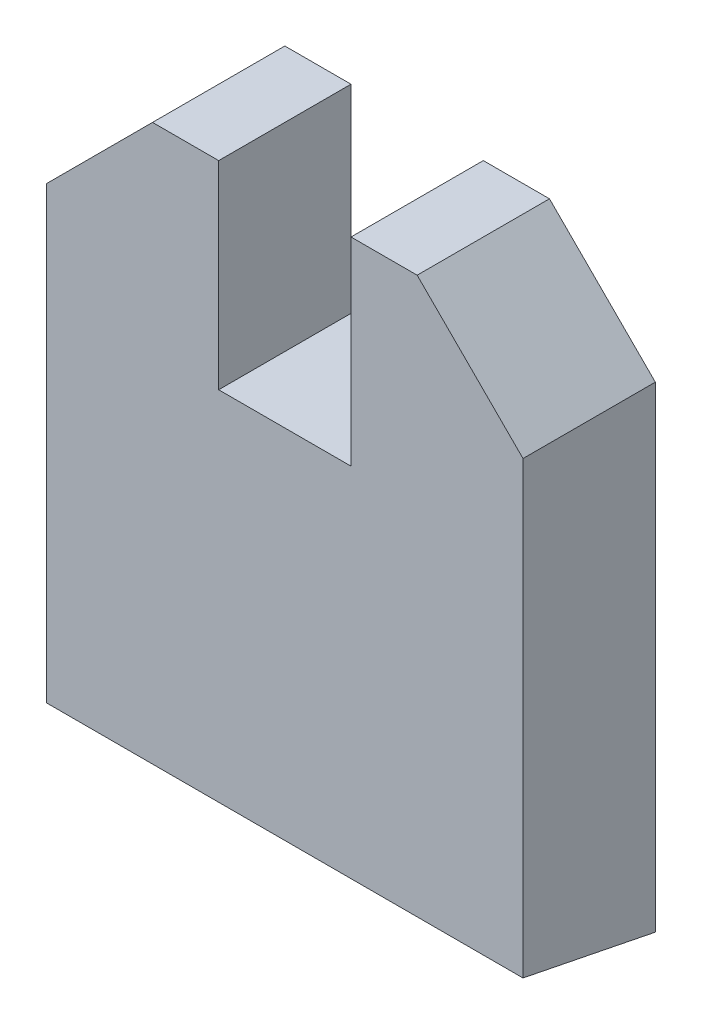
SolidWorks part; units mm, degrees
ref_plane "Face" through (0, 0, 0) normal (0, 0, 1) x (1, 0, 0)
ref_plane "Dessus" through (0, 0, 0) normal (0, 1, 0) x (1, 0, 0)
ref_plane "Droite" through (0, 0, 0) normal (1, 0, 0) x (0, 0, -1)
sketch "Esquisse1" plane through (0, 0, 0) normal (0, 0, 1) x (1, 0, 0)
  line L0 (-9, 0) -> (9, 0)
  line L1 (9, 0) -> (9, 18)
  line L2 (9, 18) -> (5, 22)
  line L3 (5, 22) -> (2.5, 22)
  line L4 (2.5, 22) -> (2.5, 14.5)
  line L5 (2.5, 14.5) -> (-2.5, 14.5)
  line L6 (0, 0) -> (0, 82.7477) construction
  line L7 (-2.5, 22) -> (-2.5, 14.5)
  line L8 (-5, 22) -> (-2.5, 22)
  line L9 (-9, 18) -> (-5, 22)
  line L10 (-9, 0) -> (-9, 18)
  point P10 (0, 14.5)
  dimension "D1" = 5
  dimension "D2" = 7.5
  dimension "D3" = 18
  dimension "D4" = 4
  dimension "D5" = 45
  dimension "D6" = 22
extrude "Extrusion1" add sketch "Esquisse1" along normal blind 5
sketch "Esquisse2" plane through (9, 0, 0) normal (1, 0, 0) x (0, 0, -1)
  line L0 (0, 0) -> (-5, 1)
  line L2 (-5, 0) -> (-5, 18) construction
  line L3 (-5, 1) -> (-5, 0)
  line L4 (-5, 0) -> (0, 0)
  line L5 (-5, 22) -> (0, 22) construction
  dimension "D1" = 21
extrude "Enlèv. mat.-Extru.1" cut sketch "Esquisse2" against normal through all
sketch "Esquisse4" plane through (0, 0, 5) normal (0, 0, 1) x (1, 0, 0)
  line L1 (0, 22.3106) -> (-11.6651, 22.3106)
  line L2 (0, 22.3106) -> (0, -0.8846)
  line L3 (0, -0.8846) -> (-11.6651, -0.8846)
  line L4 (-11.6651, 22.3106) -> (-11.6651, -0.8846)
extrude "Enlèv. mat.-Extru.3" [suppressed] cut sketch "Esquisse4" against normal through all
